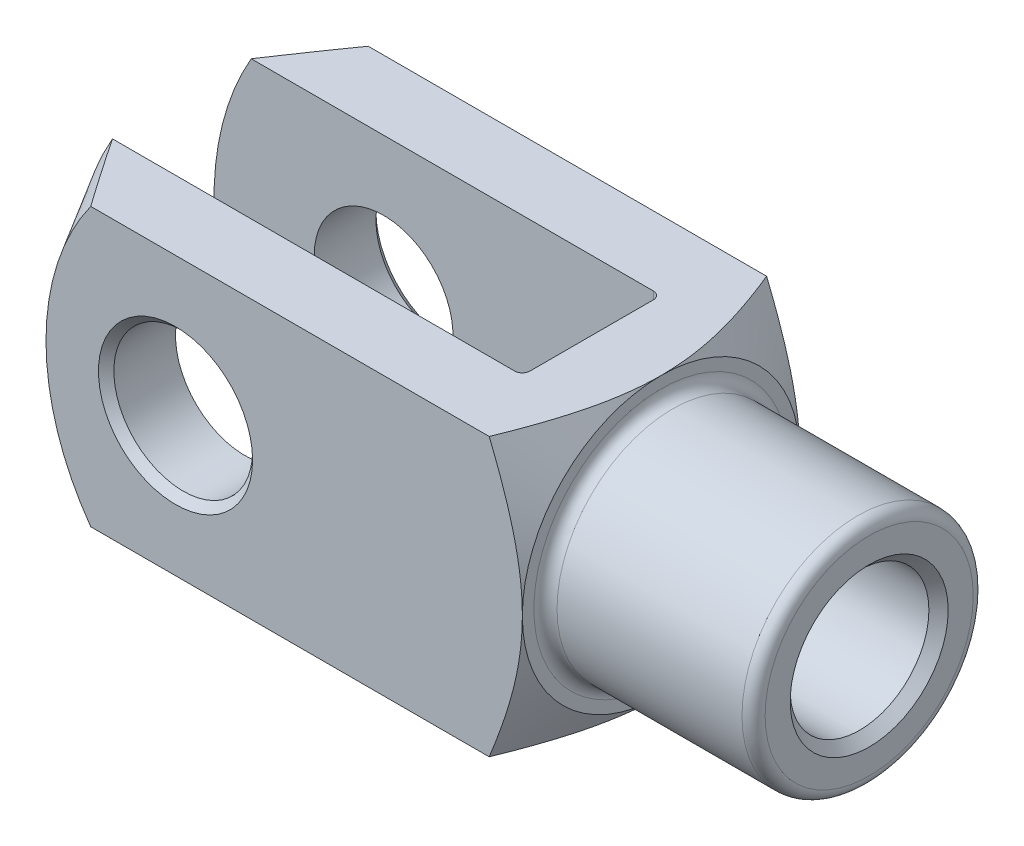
SolidWorks part; units mm, degrees
ref_plane "Front Plane" through (0, 0, 0) normal (0, 0, 1) x (1, 0, 0)
ref_plane "Top Plane" through (0, 0, 0) normal (0, 1, 0) x (1, 0, 0)
ref_plane "Right Plane" through (0, 0, 0) normal (1, 0, 0) x (0, 0, -1)
sketch "Sketch1" plane through (0, 0, 0) normal (1, 0, 0) x (0, 0, -1)
  line L0 (0, 0) -> (0, 50000) construction
  line L1 (0, 0) -> (50000, 0) construction
  line L2 (-18, -18) -> (-18, 18)
  line L3 (-18, 18) -> (18, 18)
  line L4 (18, -18) -> (18, 18)
  line L5 (-18, -18) -> (18, -18)
  point P9 (0, 18)
  point P11 (18, 0)
  point P12 (-18, 0)
  dimension "D1" = 36
  dimension "D2" = 36
extrude "Extrude1" add sketch "Sketch1" against normal blind 94
sketch "Sketch2" plane through (0, 0, 0) normal (1, 0, 0) x (0, 0, -1)
  circle A0 centre (0, 0) radius 15
  circle A1 centre (0, 0) radius 30
  dimension "D1" = 30
  dimension "D2" = 60
extrude "Extrude2" cut sketch "Sketch2" against normal blind 27
sketch "Sketch3" plane through (0, 0, 18) normal (0, 0, 1) x (1, 0, 0)
  circle A0 centre (-72, 0) radius 9
  dimension "D1" = 18
  dimension "D2" = 72
extrude "Extrude3" cut sketch "Sketch3" against normal through all
sketch "Sketch4" plane through (0, 18, 0) normal (0, 1, 0) x (1, 0, 0)
  line L0 (0, 0) -> (-50000, 0) construction
  line L1 (-94, -9) -> (-94, 9)
  line L2 (-94, 18) -> (-94, -18) construction
  line L3 (-94, 9) -> (-36, 9)
  line L4 (-36, 9) -> (-36, -9)
  line L5 (-72, 18) -> (-72, -18) construction
  line L6 (-94, -9) -> (-36, -9)
  point P7 (-72, 0)
  point P13 (-36, 0)
  point P14 (-94, 0)
  dimension "D1" = 36
  dimension "D2" = 18
extrude "Extrude4" cut sketch "Sketch4" against normal through all
fillet "Fillet1" radius 1 2 edges at (-36, 0, 9) (-36, 0, -9)
fillet "Fillet2" radius 1.5 2 edges at (0, 0, -15) (-27, 0, -15)
chamfer "Chamfer2" distance 1 angle 45 2 edges at (-63, 0, -18) (-63, 0, 18)
sketch "Sketch6" plane through (0, 0, 0) normal (0, 0, 1) x (1, 0, 0)
  line L0 (-27, -18) -> (-27, -36)
  line L1 (-27, -36) -> (-37.3923, -36)
  line L2 (-37.3923, -36) -> (-27, -18)
  dimension "D1" = 30
  dimension "D2" = 36
revolve "Cut-Revolve1" cut sketch "Sketch6" angle 360 about axis through (-27, 0, 0) along (1, 0, 0)
sketch "Sketch7" plane through (0, 0, 0) normal (0, 1, 0) x (1, 0, 0)
  line L0 (-88.8038, -18) -> (-94, -9)
  line L1 (-94, 9) -> (-88.8038, 18)
  line L2 (-88.8038, 18) -> (-130, 18)
  line L3 (-94, 9) -> (-94, -9)
  line L4 (-130, 18) -> (-130, -18)
  line L5 (-130, -18) -> (-88.8038, -18)
  line L6 (-94, 18) -> (-31.3046, 18) construction
  line L7 (-94, -18) -> (-31.3046, -18) construction
  line L8 (-58, 0.6162) -> (-58, 50000.6162) construction
  dimension "D1" = 120
  dimension "D2" = 36
  dimension "D3" = 36
revolve "Cut-Revolve2" cut sketch "Sketch7" angle 180 about L8
sketch "Sketch8" plane through (0, 0, 0) normal (1, 0, 0) x (0, 0, -1)
  circle A0 centre (0, 0) radius 9
  dimension "D1" = 18
extrude "Extrude5" cut sketch "Sketch8" against normal through all
chamfer "Chamfer3" distance 1.25 angle 45 1 edges at (0, 0, -9)
equation "\"D2@Sketch1\" = \"D1@Sketch1\""
equation "\"D2@Sketch2\" = \"D1@Sketch2\"*2"
equation "\"D2@Sketch6\" = \"D1@Sketch1\""
equation "\"D2@Sketch7\" = \"D1@Sketch1\""
equation "\"D3@Sketch7\" = \"D1@Sketch1\""
